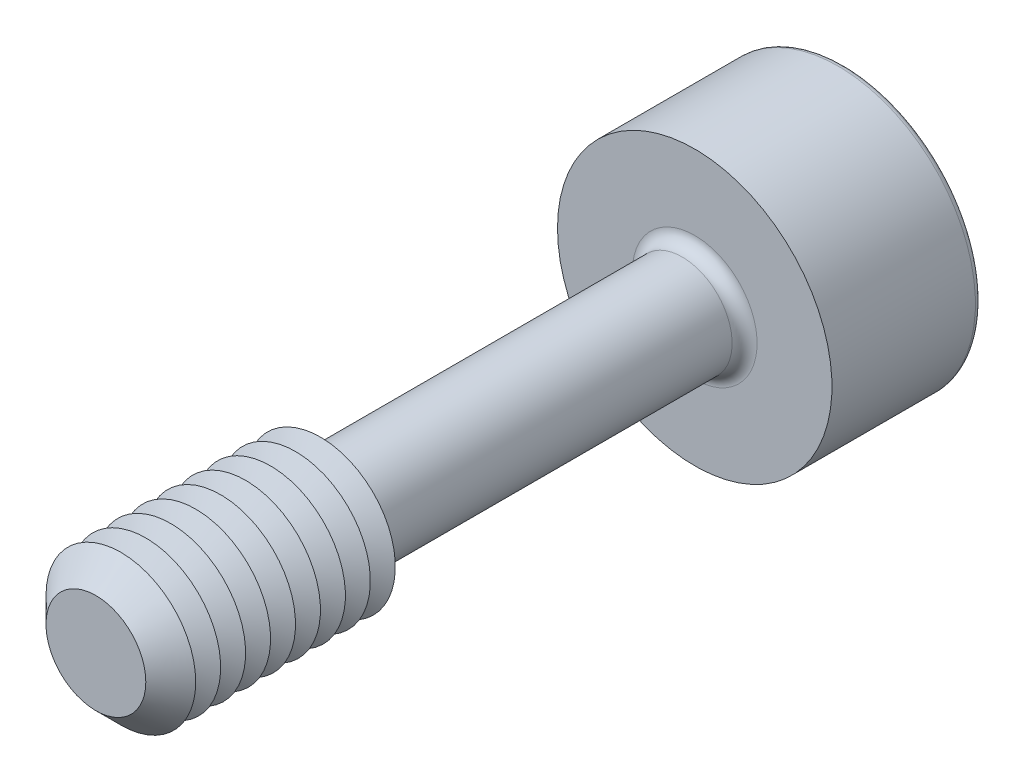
SolidWorks part; units mm, degrees
ref_plane "Front Plane" through (0, 0, 0) normal (0, 0, 1) x (1, 0, 0)
ref_plane "Top Plane" through (0, 0, 0) normal (0, 1, 0) x (1, 0, 0)
ref_plane "Right Plane" through (0, 0, 0) normal (1, 0, 0) x (0, 0, -1)
sketch "Sketch1" plane through (0, 0, 0) normal (0, 0, 1) x (1, 0, 0)
  circle A0 centre (0, 0) radius 1
  dimension "D1" = 2
extrude "Extrude1" add sketch "Sketch1" along normal mid plane 12
sketch "Sketch2" plane through (0, 0, 0) normal (1, 0, 0) x (0, 0, -1)
  line L0 (-6, 0) -> (-6, 1.5)
  line L1 (-6, 1) -> (-6, -1) construction
  line L2 (-6, 1.5) -> (-1.5, 1.5)
  line L3 (-1.5, 1.5) -> (-1.2113, 1)
  line L4 (6, 1) -> (-6, 1) construction
  line L5 (-1.2113, 1) -> (-1.2113, 0)
  line L6 (-1.2113, 0) -> (-6, 0)
  dimension "D1" = 1.5
  dimension "D2" = 120
  dimension "D3" = 4.5
revolve "Revolve1" add sketch "Sketch2" angle 360 about L6
chamfer "Chamfer1" distance 0.5 angle 45 1 edges at (0, 1.5, 6)
sketch "Sketch3" plane through (0, 0, -6) normal (0, 0, -1) x (-1, 0, 0)
  circle A0 centre (0, 0) radius 2.75
  dimension "D1" = 5.5
extrude "Extrude2" add sketch "Sketch3" along normal blind 3
sketch "Sketch4" plane through (-13.7, 0, -9) normal (0, 0, 1) x (1, 0, 0)
  line L2 (12.9783, -1.25) -> (14.4217, -1.25)
  line L3 (14.4217, -1.25) -> (15.1434, 0)
  line L4 (15.1434, 0) -> (14.4217, 1.25)
  line L6 (14.4217, 1.25) -> (12.9783, 1.25)
  line L7 (12.9783, 1.25) -> (12.2566, 0)
  line L8 (12.2566, 0) -> (12.9783, -1.25)
  circle A0 centre (13.7, 0) radius 1.25 construction
  dimension "D1" = 2.5
extrude "Extrude3" cut sketch "Sketch4" along normal blind 2.5
fillet "Fillet1" radius 0.25 1 edges at (-1, 0, -6)
fillet "Fillet2" radius 0.125 1 edges at (-2.75, 0, -9)
sketch "Sketch5" plane through (0, 0, 0) normal (1, 0, 0) x (0, 0, -1)
  line L0 (6.5, 0) -> (6.5, -1.25)
  line L1 (6.5, -1.25) -> (5.7783, 0)
  line L2 (5.7783, 0) -> (6.5, 0)
  dimension "D1" = 30
revolve "Cut-Revolve1" cut sketch "Sketch5" angle 360 about L2
sketch "Sketch6" plane through (0, 0, 0) normal (1, 0, 0) x (0, 0, -1)
  line L0 (1.332, 0) -> (-13.289, 0) construction
sketch "Sketch7" plane through (0, 0, 0) normal (1, 0, 0) x (0, 0, -1)
  line L0 (-1.5, 1.5) -> (-1.75, 1.067)
  line L1 (-1.75, 1.067) -> (-2, 1.5)
  line L2 (-1.5, 1.5) -> (-5.5, 1.5) construction
  line L3 (-2, 1.5) -> (-1.5, 1.5)
  dimension "D1" = 0.5
revolve "Cut-Revolve2" cut sketch "Sketch7" angle 360 about L0
pattern_linear "LPattern1" count 8 spacing 0.5 along (0, 0, 1) of "Cut-Revolve2"
